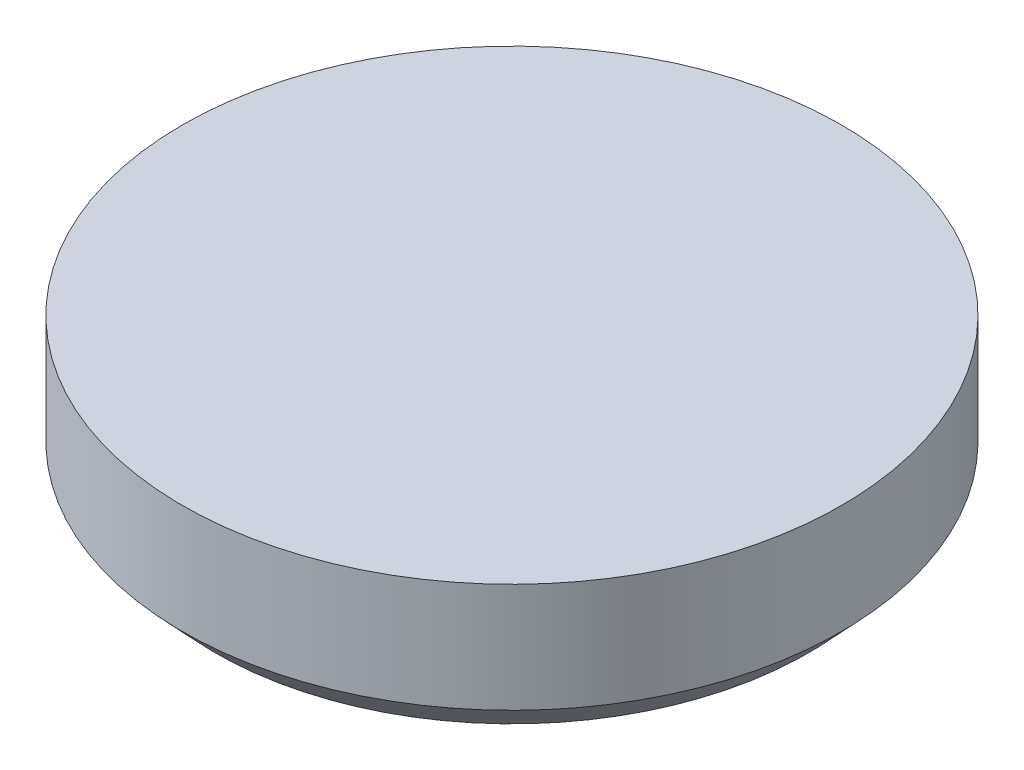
SolidWorks part; units mm, degrees
ref_plane "前视基准面" through (0, 0, 0) normal (0, 0, 1) x (1, 0, 0)
ref_plane "上视基准面" through (0, 0, 0) normal (0, 1, 0) x (1, 0, 0)
ref_plane "右视基准面" through (0, 0, 0) normal (1, 0, 0) x (0, 0, -1)
sketch "草图1" plane through (0, 0, 0) normal (0, 0, 1) x (1, 0, 0)
  line L0 (0, 350) -> (0, 0)
  line L1 (0, 350) -> (800, 350)
  line L2 (800, 350) -> (800, 85)
  line L3 (800, 85) -> (720, 0)
  line L4 (720, 0) -> (0, 0)
  dimension "D1" = 800
  dimension "D2" = 720
  dimension "D3" = 350
  dimension "D4" = 265
revolve "旋转1" add sketch "草图1" angle 360 about L0
